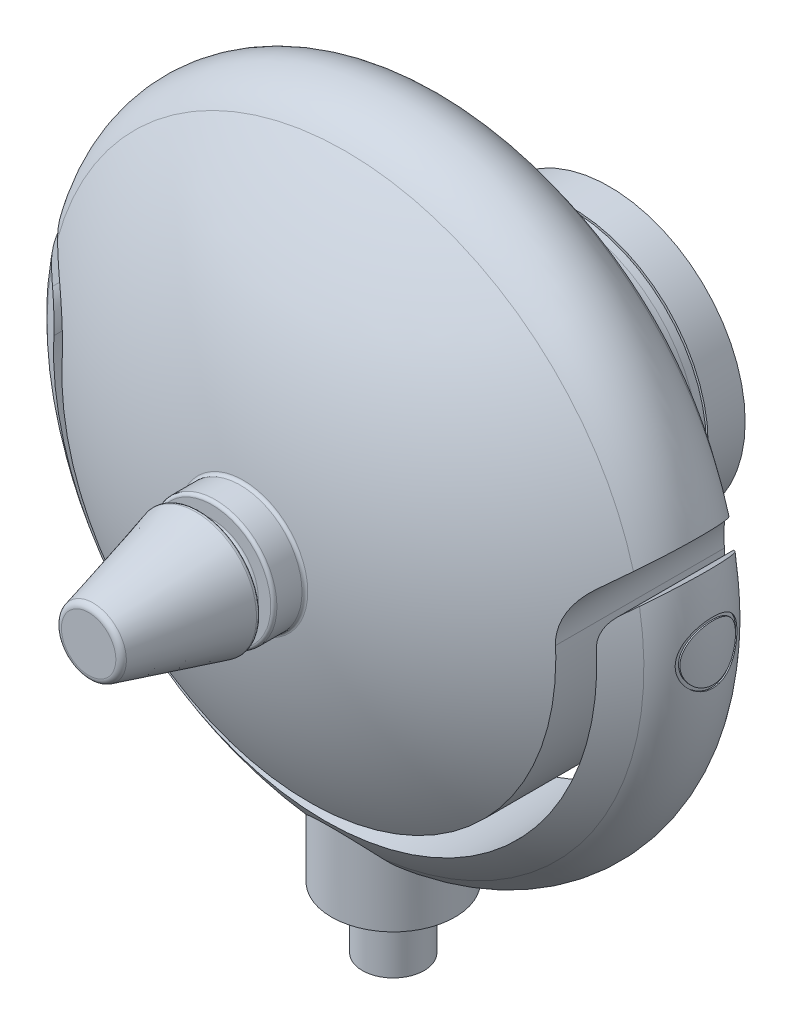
SolidWorks part; units mm, degrees
ref_plane "Спереди" through (0, 0, 0) normal (0, 0, 1) x (1, 0, 0)
ref_plane "Сверху" through (0, 0, 0) normal (0, 1, 0) x (1, 0, 0)
ref_plane "Справа" through (0, 0, 0) normal (1, 0, 0) x (0, 0, -1)
sketch "Эскиз1" plane through (0, 0, 0) normal (0, 0, 1) x (1, 0, 0)
  line L0 (0, 179.3839) -> (0, -157.5829) construction
  line L1 (-100.4739, 0) -> (221.327, 0) construction
  line L2 (0, -100) -> (50, -100)
  line L3 (50, -100) -> (50, 0)
  line L4 (50, 0) -> (100, 0)
  line L5 (100, 0) -> (100, 150)
  line L6 (100, 150) -> (0, 150)
  line L7 (0, 150) -> (0, -100)
  dimension "D1" = 150
  dimension "D2" = 100
  dimension "D3" = 50
  dimension "D4" = 100
revolve "Повернуть1" add sketch "Эскиз1" angle 360 about L0
sketch "Эскиз2" plane through (0, 0, 0) normal (1, 0, 0) x (0, 0, -1)
  line L0 (0, 1243.5427) -> (0, -116.8571) construction
  line L1 (-253.3227, 0) -> (365.9105, 0) construction
  line L2 (-782.0659, 580) -> (729.0698, 580) construction
  line L3 (-250, 580) -> (-250, 842.4562) construction
  line L4 (0, 60) -> (350.2887, 60) construction
  line L5 (-493.4185, 580) -> (-493.4185, 535.9041)
  line L6 (-486.0067, 526.2449) -> (-319.7126, 481.6865)
  line L7 (-313.4185, 486.5161) -> (-313.4185, 505)
  line L8 (-308.4185, 510) -> (-298.4185, 510)
  line L9 (-293.4185, 505) -> (-293.4185, 485)
  line L10 (-288.4185, 480) -> (-247.7884, 480)
  line L11 (-293.4185, 480) -> (-782.0659, 480) construction
  line L12 (350, 360) -> (350, 375)
  line L13 (350, 360) -> (290, 360)
  line L14 (172.7594, 410) -> (414.2083, 410) construction
  line L15 (350, 375) -> (340, 375)
  line L16 (340, 375) -> (344.5237, 391.8827)
  line L17 (350, 460) -> (350, 445)
  line L18 (350, 445) -> (340, 445)
  line L19 (340, 445) -> (344.5237, 428.1173)
  line L20 (350, 460) -> (280, 460)
  line L21 (280, 460) -> (280, 510)
  line L22 (280, 510) -> (220, 510)
  line L23 (220, 510) -> (220, 560)
  line L24 (220, 560) -> (150, 560)
  line L25 (150, 560) -> (150, 580)
  line L26 (150, 580) -> (-493.4185, 580)
  line L27 (287, 360) -> (287, 365)
  line L28 (287, 365) -> (290, 365)
  line L29 (290, 365) -> (290, 360)
  line L30 (287, 360) -> (274.8128, 360)
  line L31 (191.4998, 287) -> (187.74, 287)
  line L32 (187.74, 287) -> (187.74, 290)
  line L33 (187.74, 290) -> (192.74, 290)
  arc A0 (77.3756, 96.6516) -> (-77.3756, 96.6516) centre (0, 160) cw
  arc A1 (-250, 580) -> (-77.3756, 96.6516) centre (513, 580) ccw construction
  arc A2 (250, 580) -> (77.3756, 96.6516) centre (-513, 580) cw construction
  arc A3 (-242.8354, 475.6836) -> (-77.3756, 96.6516) centre (513, 580) ccw
  arc A4 (200.05, 308.4698) -> (192.74, 290) centre (-513.0001, 580) cw
  arc A5 (344.5237, 391.8827) -> (344.5237, 428.1173) centre (276.9089, 410) ccw
  arc A6 (200.05, 308.4698) -> (274.8128, 360) centre (274.8128, 280) cw
  arc A7 (191.4998, 287) -> (77.3756, 96.6516) centre (-513.0001, 580) cw
  arc A8 (-313.4185, 505) -> (-308.4185, 510) centre (-308.4185, 505) cw
  arc A9 (-298.4185, 510) -> (-293.4185, 505) centre (-298.4185, 505) cw
  arc A10 (-293.4185, 485) -> (-288.4185, 480) centre (-288.4185, 485) ccw
  arc A11 (-242.8354, 475.6836) -> (-247.7884, 480) centre (-247.7884, 475) ccw
  arc A12 (-493.4185, 535.9041) -> (-486.0067, 526.2449) centre (-483.4185, 535.9041) ccw
  arc A13 (-319.7126, 481.6865) -> (-313.4185, 486.5161) centre (-318.4185, 486.5161) ccw
  point P26 (-268.1035, 480)
  point P46 (349.3782, 410)
  point P49 (217.595, 360)
  point P67 (-243.4185, 480)
  point P72 (-313.4185, 480)
  dimension "D4" = 100
  dimension "D22" = 70
  dimension "D23" = 80
  dimension "D30" = 5
  dimension "D31" = 10
  dimension "D32" = 5
  dimension "D1" = 580
  dimension "D2" = 250
  dimension "D3" = 60
  dimension "D5" = 100
  dimension "D6" = 50
  dimension "D7" = 20
  dimension "D8" = 30
  dimension "D9" = 250
  dimension "D10" = 15
  dimension "D11" = 220
  dimension "D12" = 350
  dimension "D13" = 50
  dimension "D14" = 15
  dimension "D15" = 10
  dimension "D16" = 15
  dimension "D17" = 70
  dimension "D18" = 50
  dimension "D19" = 50
  dimension "D20" = 60
  dimension "D21" = 70
  dimension "D24" = 60
  dimension "D25" = 5
  dimension "D26" = 3
  dimension "D27" = 290
  dimension "D28" = 3
  dimension "D29" = 5
revolve "Повернуть2" add sketch "Эскиз2" angle 360 about L2
ref_plane "Плоскость1" through (600, 0, 0) normal (1, 0, 0) x (0, 0, -1)
sketch "Эскиз3" plane through (600, 0, 0) normal (1, 0, 0) x (0, 0, -1)
  line L0 (0, 1155.4283) -> (0, -136.591) construction
  line L1 (350, 580) -> (-555.9395, 580) construction
  line L2 (350, 360) -> (350, 800) construction
  circle A0 centre (0, 580) radius 50
  circle A1 centre (0, 580) radius 45
  dimension "D1" = 100
  dimension "D2" = 90
extrude "Вырез-Вытянуть1" cut sketch "Эскиз3" against normal offset from surface (92.9425 mm away) 2
ref_plane "Плоскость2" through (-600, 0, 0) normal (1, 0, 0) x (0, 0, -1)
sketch "Эскиз4" plane through (-600, 0, 0) normal (1, 0, 0) x (0, 0, -1)
  line L0 (0, 1141.0233) -> (0, -141.0233) construction
  circle A1 centre (0, 580) radius 45
  circle A2 centre (0, 580) radius 45
  circle A3 centre (0, 580) radius 50
  circle A4 centre (0, 580) radius 50
  dimension "D1" = 0
  dimension "D2" = 0
extrude "Вырез-Вытянуть2" cut sketch "Эскиз4" along normal offset from surface (92.9425 mm away) 2
sketch "Эскиз5" plane through (0, 0, 0) normal (0, 0, 1) x (1, 0, 0)
  line L0 (0, 1133.2667) -> (0, -131.0506) construction
  line L1 (-797.8164, 580) -> (659.3066, 580) construction
  line L2 (-460.8597, 649.8949) -> (-560, 733.0835)
  line L3 (-560, 733.0835) -> (-560, 785.2998)
  line L4 (-560, 785.2998) -> (-435.1482, 680.5367)
  line L5 (560, 733.0835) -> (560, 785.2998)
  line L6 (460.8597, 649.8949) -> (560, 733.0835)
  line L7 (560, 785.2998) -> (435.1482, 680.5367)
  arc A0 (439.4957, 601.0604) -> (-439.4957, 601.0604) centre (0, 580) cw
  arc A1 (399.5415, 599.1458) -> (-399.5415, 599.1458) centre (0, 580) cw
  arc A2 (-439.4957, 601.0604) -> (-460.8597, 649.8949) centre (-499.4269, 603.9322) ccw
  arc A3 (-399.5415, 599.1458) -> (-435.1482, 680.5367) centre (-499.4269, 603.9322) ccw
  arc A4 (399.5415, 599.1458) -> (435.1482, 680.5367) centre (499.4269, 603.9322) cw
  arc A5 (439.4957, 601.0604) -> (460.8597, 649.8949) centre (499.4269, 603.9322) cw
  point P16 (-437.1499, 630)
  dimension "D1" = 440
  dimension "D7" = 60
  dimension "D8" = 100
  dimension "D3" = 40
  dimension "D4" = 50
  dimension "D6" = 560
extrude "Вырез-Вытянуть3" cut sketch "Эскиз5" against normal mid plane 300
split "Разделить1" trim tools "Плоскость2" bodies to split 107 108 resulting bodies 109 110
